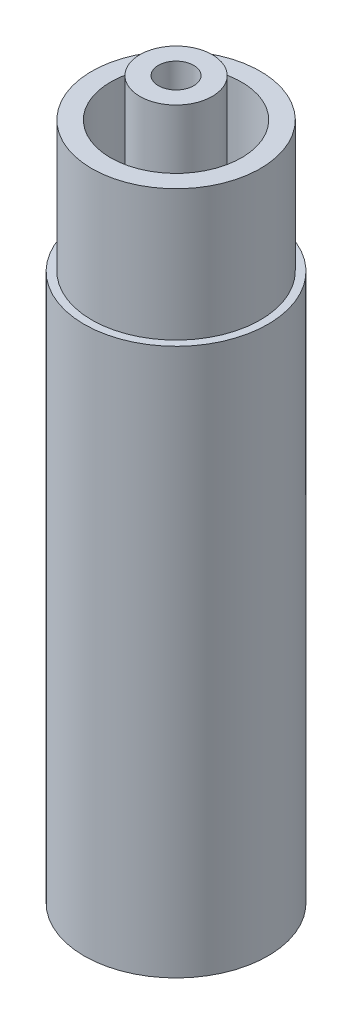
SolidWorks part; units mm, degrees
ref_plane "Front Plane" through (0, 0, 0) normal (0, 0, 1) x (1, 0, 0)
ref_plane "Top Plane" through (0, 0, 0) normal (0, 1, 0) x (1, 0, 0)
ref_plane "Right Plane" through (0, 0, 0) normal (1, 0, 0) x (0, 0, -1)
sketch "Sketch1" plane through (0, 0, 0) normal (0, 0, 1) x (1, 0, 0)
  line L0 (0, 0) -> (0, -74.4589) construction
  line L1 (-4.1402, 0) -> (-5.1625, 0)
  line L2 (-5.1625, 0) -> (-5.1625, 30.734)
  line L3 (-5.1625, 30.734) -> (-4.7371, 30.734)
  line L4 (-4.7371, 30.734) -> (-4.7371, 38.1)
  line L5 (-4.7371, 38.1) -> (-3.683, 38.1)
  line L6 (-3.683, 38.1) -> (-3.683, 30.734)
  line L7 (-3.683, 30.734) -> (-2.032, 30.734)
  line L8 (-2.032, 30.734) -> (-2.032, 40.259)
  line L9 (-2.032, 40.259) -> (-0.9945, 40.259)
  line L11 (-4.1402, 0) -> (-4.1402, 27.9635)
  line L12 (-4.1402, 27.9635) -> (-0.9945, 29.7797)
  line L13 (-0.9945, 29.7797) -> (-0.9945, 40.259)
  dimension "D1" = 10.3251
  dimension "D2" = 9.4742
  dimension "D3" = 7.366
  dimension "D4" = 9.525
  dimension "D5" = 4.064
  dimension "D6" = 7.366
  dimension "D7" = 38.1
  dimension "D8" = 8.2804
  dimension "D9" = 10.4793
  dimension "D10" = 120
  dimension "D11" = 1.0375
revolve "Revolve1" add sketch "Sketch1" angle 360 about L0
sketch "Sketch2" plane through (0, 0, 0) normal (0, 0, 1) x (1, 0, 0)
  line L0 (0, 11.6623) -> (-4.1275, 10.16)
  line L1 (-4.1275, 10.16) -> (-4.1275, 6.35)
  line L2 (-4.1275, 6.35) -> (0, 6.35)
  line L3 (0, 6.35) -> (0, 11.6623)
  line L4 (0, 0) -> (0, 11.6623) construction
  dimension "D1" = 8.255
  dimension "D2" = 70
  dimension "D3" = 3.81
  dimension "D4" = 6.35
revolve "Revolve2" add sketch "Sketch2" angle 360 about L4
